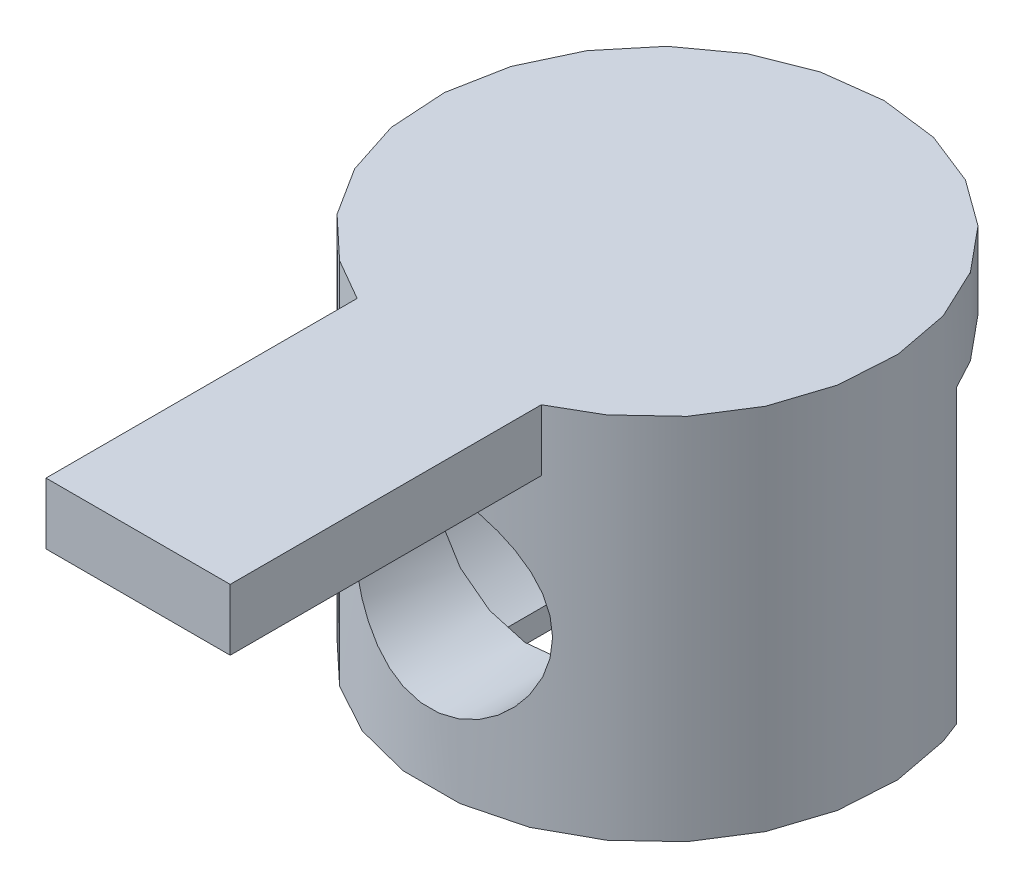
SolidWorks part; units mm, degrees
ref_plane "正面" through (0, 0, 0) normal (0, 0, 1) x (1, 0, 0)
ref_plane "平面" through (0, 0, 0) normal (0, 1, 0) x (1, 0, 0)
ref_plane "右側面" through (0, 0, 0) normal (1, 0, 0) x (0, 0, -1)
sketch "ｽｹｯﾁ1" plane through (0, 0, 0) normal (0, 1, 0) x (1, 0, 0)
  circle A0 centre (0, 0) radius 7.4
  dimension "D1" = 14.8
extrude "押し出し1" add sketch "ｽｹｯﾁ1" along normal blind 12
sketch "ｽｹｯﾁ2" plane through (0, 12, 0) normal (0, 1, 0) x (-1, 0, 0)
  line L1 (3, 0) -> (-3, 0)
  line L2 (3, 0) -> (3, 16.9)
  line L3 (3, 16.9) -> (-3, 16.9)
  line L4 (-3, 0) -> (-3, 16.9)
  dimension "D1" = 3
  dimension "D2" = 16.9
  dimension "D3" = 6
extrude "押し出し2" add sketch "ｽｹｯﾁ2" against normal blind 2
ref_plane "平面1" through (0, 0, -7.4) normal (0, 0, 1) x (1, 0, 0)
hole_wizard "穴1" positions "ｽｹｯﾁ7" profile "ｽｹｯﾁ6" legacy
sketch "ｽｹｯﾁ7" plane through (0, 0, -7.4) normal (0, 0, 1) x (1, 0, 0)
  line L0 (-7.4, 0) -> (7.4, 0) construction
  line L1 (0, 12) -> (0, 0) construction
  line L2 (7.4, 12) -> (-7.4, 12) construction
  point P0 (0, 5.5)
  dimension "D1" = 5.5
sketch "ｽｹｯﾁ6" plane through (0, 5.5, -7.4) normal (1, 0, 0) x (0, 1, 0)
  line L0 (0, 0) -> (0, 24.3)
  line L1 (0, 24.3) -> (3.25, 24.3)
  line L2 (3.25, 24.3) -> (3.25, 11.4)
  line L3 (3.25, 11.4) -> (5.35, 11.4)
  line L4 (5.35, 11.4) -> (5.35, 0)
  line L5 (5.35, 0) -> (0, 0)
  line L6 (0, 110) -> (0, -10) construction
  dimension "直径" = 6.5
  dimension "深さ" = 24.3
  dimension "座ぐり穴-直径" = 10.7
  dimension "座ぐり穴-深さ" = 11.4
sketch "ｽｹｯﾁ4" plane through (0, 0, 0) normal (1, 0, 0) x (0, 0, -1)
  line L0 (-7.4, 0) -> (7.4, 0) construction
  line L1 (3, 0) -> (7.4, 0)
  line L2 (3, 0) -> (3, 9.5)
  line L3 (3, 9.5) -> (7.4, 9.5)
  line L4 (7.4, 0) -> (7.4, 9.5)
  line L6 (7.4, 6.6) -> (7.4, -6.6) construction
  dimension "D1" = 9.5
  dimension "D2" = 4.4
extrude "ｶｯﾄ - 押し出し1" cut sketch "ｽｹｯﾁ4" against normal mid plane 14.8
sketch "ｽｹｯﾁ8" plane through (0, 0, 0) normal (0, -1, 0) x (1, 0, 0)
  line L0 (-6.7646, -3) -> (6.7646, -3) construction
  line L1 (-2.5, -3) -> (2.5, -3)
  line L2 (-2.5, -3) -> (-2.5, 3.5)
  line L3 (-2.5, 3.5) -> (2.5, 3.5)
  line L4 (2.5, -3) -> (2.5, 3.5)
  dimension "D1" = 5
  dimension "D2" = 2.5
  dimension "D3" = 6.5
extrude "ｶｯﾄ - 押し出し2" cut sketch "ｽｹｯﾁ8" against normal blind 5.5
